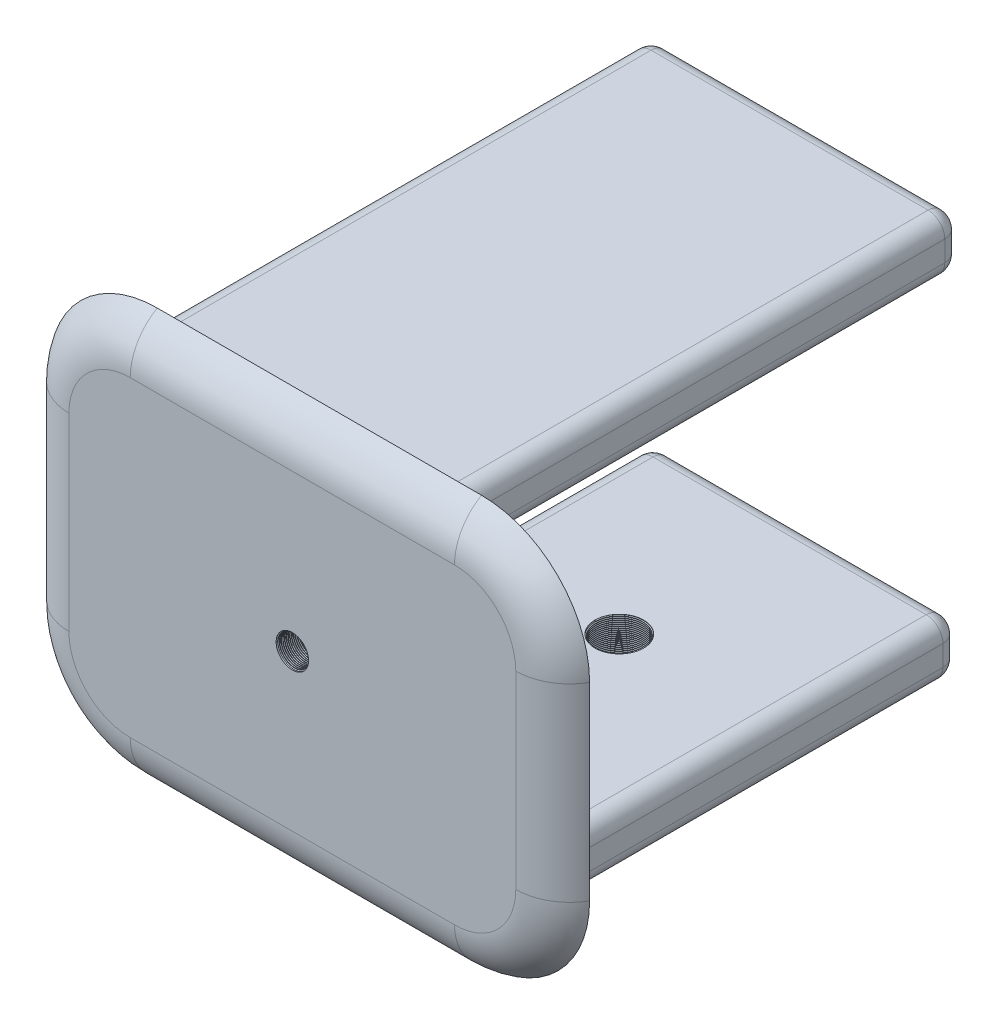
SolidWorks part; units mm, degrees
ref_plane "Front Plane" through (0, 0, 0) normal (0, 0, 1) x (1, 0, 0)
ref_plane "Top Plane" through (0, 0, 0) normal (0, 1, 0) x (1, 0, 0)
ref_plane "Right Plane" through (0, 0, 0) normal (1, 0, 0) x (0, 0, -1)
sketch "Sketch5" plane through (0, 0, 0) normal (0, 0, 1) x (1, 0, 0)
  line L1 (-30, 37.5) -> (30, 37.5)
  line L2 (-50, 17.5) -> (-50, -17.5)
  line L3 (-30, -37.5) -> (30, -37.5)
  line L4 (50, 17.5) -> (50, -17.5)
  line L5 (-50, 37.5) -> (50, -37.5) construction
  line L6 (-50, -37.5) -> (50, 37.5) construction
  arc A0 (-30, 37.5) -> (-50, 17.5) centre (-30, 17.5) ccw
  arc A1 (-50, -17.5) -> (-30, -37.5) centre (-30, -17.5) ccw
  arc A2 (30, -37.5) -> (50, -17.5) centre (30, -17.5) ccw
  arc A3 (30, 37.5) -> (50, 17.5) centre (30, 17.5) cw
  point P0 (0, 0)
  dimension "D1" = 20
extrude "Boss-Extrude1" add sketch "Sketch5" along normal blind 5 contours L2 A1 L3 A2 L4 A3 L1 A0
fillet "Fillet1" radius 10 8 edges at (-44.1421, -31.6421, 5) (-50, 0, 5) (-44.1421, 31.6421, 5) (0, 37.5, 5) (44.1421, 31.6421, 5) (50, 0, 5) (44.1421, -31.6421, 5) (0, -37.5, 5)
sketch "Sketch6" plane through (0, 0, 0) normal (0, 0, 1) x (1, 0, 0)
  line L1 (25.6265, 37.5) -> (-25.6265, 37.5)
  line L2 (28.7139, 34.4126) -> (28.7139, 30.5874)
  line L3 (25.6265, 27.5) -> (-25.6265, 27.5)
  line L4 (-28.7139, 34.4126) -> (-28.7139, 30.5874)
  line L5 (28.7139, 35) -> (-28.7139, 25) construction
  line L6 (28.7139, 25) -> (-28.7139, 35) construction
  line L8 (25.2787, -27.5) -> (-25.2787, -27.5)
  line L9 (28.3661, -30.5874) -> (28.3661, -34.4126)
  line L10 (25.2787, -37.5) -> (-25.2787, -37.5)
  line L11 (-28.3661, -30.5874) -> (-28.3661, -34.4126)
  line L14 (-30, -37.5) -> (30, -37.5) construction
  line L17 (-30, 37.5) -> (30, 37.5) construction
  arc A0 (-25.6265, 27.5) -> (-28.7139, 30.5874) centre (-25.6265, 30.5874) cw
  arc A1 (-25.6265, 37.5) -> (-28.7139, 34.4126) centre (-25.6265, 34.4126) ccw
  arc A2 (28.7139, 30.5874) -> (25.6265, 27.5) centre (25.6265, 30.5874) cw
  arc A3 (25.6265, 37.5) -> (28.7139, 34.4126) centre (25.6265, 34.4126) cw
  arc A4 (-25.2787, -37.5) -> (-28.3661, -34.4126) centre (-25.2787, -34.4126) cw
  arc A5 (-25.2787, -27.5) -> (-28.3661, -30.5874) centre (-25.2787, -30.5874) ccw
  arc A6 (28.3661, -34.4126) -> (25.2787, -37.5) centre (25.2787, -34.4126) cw
  arc A7 (25.2787, -27.5) -> (28.3661, -30.5874) centre (25.2787, -30.5874) cw
  point P0 (0, 30)
  point P5 (0, -37.5)
  point P22 (0, 37.5)
  point P35 (0, 37.5)
  dimension "D1" = 3.0874
  dimension "D2" = 10
  dimension "D3" = 10
extrude "Boss-Extrude2" add sketch "Sketch6" against normal blind 90
sketch "Sketch8" plane through (0, 27.5, 0) normal (0, -1, 0) x (1, 0, 0)
  line L1 (-4.3, -15) -> (4.3, -15)
  line L2 (-4.3, -15) -> (-4.3, -60)
  line L3 (-4.3, -60) -> (4.3, -60)
  line L4 (4.3, -15) -> (4.3, -60)
  line L5 (-4.3, -15) -> (4.3, -60) construction
  line L6 (-4.3, -60) -> (4.3, -15) construction
  line L7 (-25.6265, -90) -> (25.6265, -90) construction
  point P0 (0, -37.5)
  point P9 (0, -60)
  point P12 (0, -90)
  dimension "D1" = 30
extrude "Cut-Extrude2" cut sketch "Sketch8" against normal blind 5 contours L2 L3 L4 L1
sketch "Sketch9" plane through (0, -37.5, 0) normal (0, -1, 0) x (1, 0, 0)
  line L1 (-25.2787, -90) -> (25.2787, -90) construction
  circle A0 centre (0, -55.5) radius 4.5
  dimension "D1" = 34.5
extrude "Cut-Extrude3" cut sketch "Sketch9" against normal blind 15 contours A0
fillet "Fillet2" radius 3 8 edges at (0, -37.5, -90) (27.4618, -36.5957, -90) (28.3661, -32.5, -90) (27.4618, -28.4043, -90) (0, -27.5, -90) (-27.4618, -28.4043, -90) (-28.3661, -32.5, -90) (-27.4618, -36.5957, -90)
ref_plane "Plane1" through (0, 0, -90) normal (0, 0, -1) x (-1, 0, 0)
ref_plane "Plane2" through (0, 0, -85) normal (0, 0, -1) x (-1, 0, 0)
sketch "Sketch12" plane through (0, 0, -85) normal (0, 0, -1) x (-1, 0, 0)
  line L0 (-4.3, 33.5) -> (4.3, 33.5)
  line L1 (-4.3, 33.5) -> (-4.3, 31.5)
  line L2 (-4.3, 31.5) -> (4.3, 31.5)
  line L3 (4.3, 33.5) -> (4.3, 31.5)
  line L4 (25.6265, 27.5) -> (-25.6265, 27.5) construction
  line L5 (-28.7139, 30.5874) -> (-28.7139, 34.4126) construction
  point P4 (0, 31.5)
  point P7 (0, 27.5)
  point P8 (-4.3, 32.5)
  point P11 (-28.7139, 32.5)
extrude "Cut-Extrude6" cut sketch "Sketch12" against normal blind 80
fillet "Fillet8" radius 3 8 edges at (0, 27.5, -90) (27.8096, 28.4043, -90) (28.7139, 32.5, -90) (27.8096, 36.5957, -90) (0, 37.5, -90) (-27.8096, 36.5957, -90) (-28.7139, 32.5, -90) (-27.8096, 28.4043, -90)
thread "Thread1" pitch 0.3175 start angle 0, offset 0, length 8, pitch 0.3175, diameter 9
ref_plane "Plane4" through (-4.5, -27.5, -55.5) normal (0, 0, 1) x (-1, 0, 0)
sketch "Thread Profile1" plane through (-4.5, -27.5, -55.5) normal (0, 0, 1) x (-1, 0, 0)
  line L0 (0, 0) -> (0, 0.3175) construction
  line L11 (0, 0) -> (0, 0.2778)
  line L12 (0, 0.2778) -> (-0.1719, 0.1786)
  line L13 (-0.1719, 0.1786) -> (-0.1719, 0.0992)
  line L15 (-0.1719, 0.0992) -> (0, 0)
  line L17 (-0.1719, 0.1389) -> (0, 0.1389) construction
  point P2 (0, 0)
  dimension "Pitch" = 0.3175
  dimension "Profile_Angle" = 60
  dimension "Profile_Land" = 0.0794
  dimension "Profile_Height" = 0.1719
sketch "Sketch17" plane through (0, 0, 5) normal (0, 0, 1) x (1, 0, 0)
  circle A0 centre (0, 0) radius 3
extrude "Cut-Extrude8" cut sketch "Sketch17" against normal blind 5
thread "Thread2" pitch 0.3175 start angle 0, offset 0, length 5, pitch 0.3175, diameter 6
ref_plane "Plane5" through (-3, 0, 5) normal (0, -1, 0) x (-1, 0, 0)
sketch "Thread Profile2" plane through (-3, 0, 5) normal (0, -1, 0) x (-1, 0, 0)
  line L0 (0, 0) -> (0, 0.3175) construction
  line L11 (0, 0) -> (0, 0.2778)
  line L12 (0, 0.2778) -> (-0.1719, 0.1786)
  line L13 (-0.1719, 0.1786) -> (-0.1719, 0.0992)
  line L15 (-0.1719, 0.0992) -> (0, 0)
  line L17 (-0.1719, 0.1389) -> (0, 0.1389) construction
  point P2 (0, 0)
  dimension "Pitch" = 0.3175
  dimension "Profile_Angle" = 60
  dimension "Profile_Land" = 0.0794
  dimension "Profile_Height" = 0.1719
